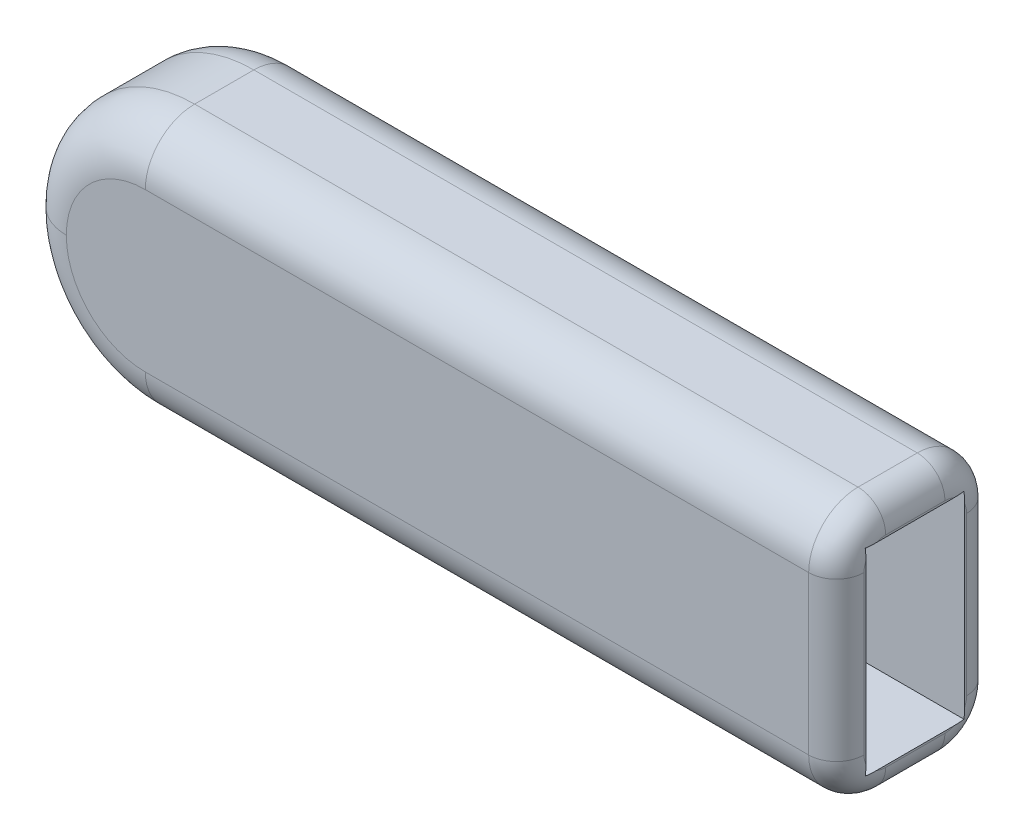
SolidWorks part; units mm, degrees
ref_plane "Plane1" through (0, 0, 0) normal (0, 0, 1) x (1, 0, 0)
ref_plane "Plane2" through (0, 0, 0) normal (0, 1, 0) x (-1, 0, 0)
ref_plane "Plane3" through (0, 0, 0) normal (1, 0, 0) x (0, 0, -1)
sketch "Sketch1" plane through (0, 0, 0) normal (0, 0, 1) x (1, 0, 0)
  line L0 (0, 0) -> (50.8, 0)
  line L1 (0, 0) -> (0, 12.7)
  line L2 (50.8, 12.7) -> (0, 12.7)
  line L3 (50.8, 12.7) -> (50.8, 0)
  point P0 (-2.5805, 1.2902)
  dimension "D1" = 12.7
  dimension "D2" = 50.8
extrude "Base-Extrude" add sketch "Sketch1" along normal blind 6.35
fillet "Fillet1" radius 6.35 4 edges at (0, 6.35, 6.35) (0, 6.35, 0) (0, 0, 3.175) (0, 12.7, 3.175)
shell "Shell1" thickness 1.905
fillet "Fillet3" radius 3.175 8 edges at (28.575, -1.905, -1.905) (0.5128, 0.5128, -1.905) (0.5128, 12.1872, -1.905) (28.575, -1.905, 8.255) (0.5128, 0.5128, 8.255) (0.5128, 12.1872, 8.255) (28.575, 14.605, -1.905) (28.575, 14.605, 8.255)
fillet "Fillet4" radius 1.778 8 edges at (50.8, -1.905, 3.175) (50.8, 6.35, -1.905) (50.8, 14.605, 3.175) (50.8, 6.35, 8.255) (50.8, 13.6751, 7.3251) (50.8, 13.6751, -0.9751) (50.8, -0.9751, 7.3251) (50.8, -0.9751, -0.9751)
